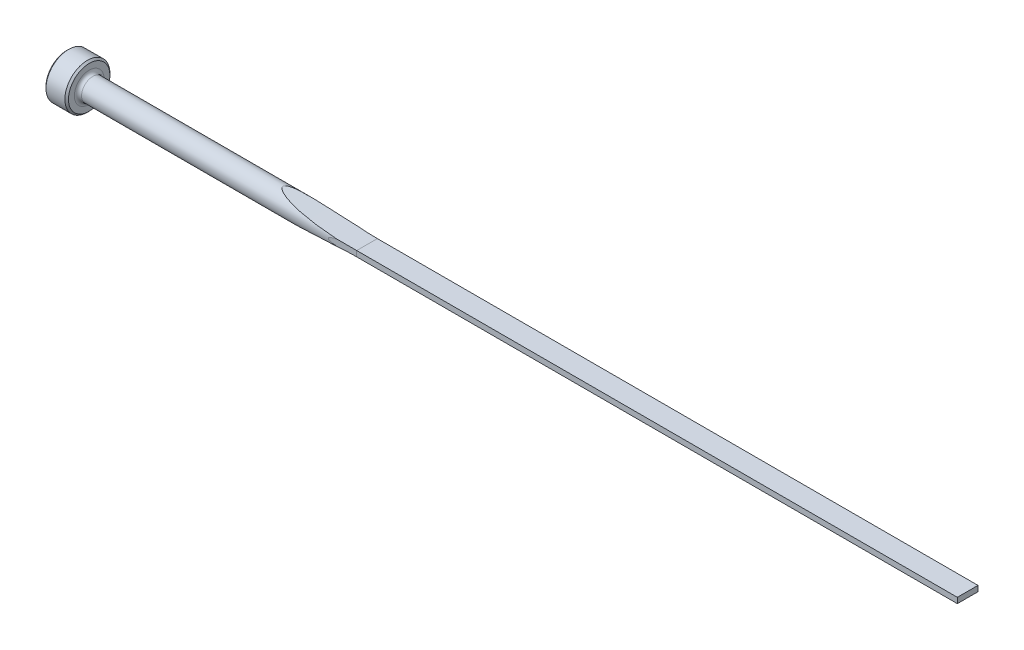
SolidWorks part; units mm, degrees
ref_plane "Front Plane" through (0, 0, 0) normal (0, 0, 1) x (1, 0, 0)
ref_plane "Top Plane" through (0, 0, 0) normal (0, 1, 0) x (1, 0, 0)
ref_plane "Right Plane" through (0, 0, 0) normal (1, 0, 0) x (0, 0, -1)
sketch "Sketch1" plane through (0, 0, 0) normal (0, 0, 1) x (1, 0, 0)
  line L0 (0, 0) -> (167.7268, 0) construction
  line L1 (0, 0) -> (0, 4.7625)
  line L2 (0, 4.7625) -> (4.7498, 4.7625)
  line L3 (4.7498, 4.7625) -> (4.7498, 2.3749)
  line L4 (4.7498, 2.3749) -> (190.5, 2.3749)
  line L5 (190.5, 2.3749) -> (190.5, 0)
  line L6 (190.5, 0) -> (0, 0)
  dimension "D1" = 190.5
  dimension "D2" = 9.525
  dimension "D3" = 4.7498
  dimension "D4" = 4.7498
revolve "Revolve1" add sketch "Sketch1" angle 360 about L0
sketch "Sketch2" plane through (0, 0, 0) normal (0, 0, 1) x (1, 0, 0)
  line L0 (190.5, 2.3749) -> (190.5, 0.5842)
  line L1 (190.5, -2.3749) -> (190.5, 2.3749) construction
  line L2 (190.5, 0.5842) -> (63.5, 0.5842)
  line L3 (190.5, 2.3749) -> (4.7498, 2.3749) construction
  line L4 (45.7467, 2.3749) -> (190.5, 2.3749)
  line L5 (166.0833, 0) -> (153.1705, 0) construction
  arc A0 (63.5, 0.5842) -> (45.7467, 2.3749) centre (63.5, 89.4842) cw
  dimension "D1" = 88.9
  dimension "D3" = 127
  dimension "D2" = 1.1684
  dimension "D4" = 17.7533
extrude "Cut-Extrude1" cut sketch "Sketch2" against normal through all both and the other way through all
mirror "Mirror1" about plane through (0, 0, 0) normal (0, 1, 0) of "Cut-Extrude1"
sketch "Sketch3" plane through (0, 0, 0) normal (0, 1, 0) x (1, 0, 0)
  line L0 (190.5, 2.3749) -> (190.5, 2.1844)
  line L1 (190.5, 2.3019) -> (190.5, -2.3019) construction
  line L2 (190.5, 2.1844) -> (63.5, 2.1844)
  line L3 (190.5, 2.3749) -> (4.7498, 2.3749) construction
  line L4 (57.6832, 2.3749) -> (190.5, 2.3749)
  line L5 (163.4716, 0) -> (166.2513, 0) construction
  line L6 (63.5, 2.3019) -> (63.5, -2.3019) construction
  arc A0 (63.5, 2.1844) -> (57.6832, 2.3749) centre (63.5, 91.0844) cw
  dimension "D2" = 88.9
  dimension "D1" = 4.3688
extrude "Cut-Extrude2" cut sketch "Sketch3" against normal through all both and the other way through all
mirror "Mirror2" about plane through (0, 0, 0) normal (0, 0, 1) of "Cut-Extrude2"
fillet "Fillet1" radius 0.762 1 edges at (4.7498, 0, 2.3749)
chamfer "Chamfer1" distance 0.381 angle 45 2 edges at (0, 0, 4.7625) (4.7498, 0, 4.7625)
